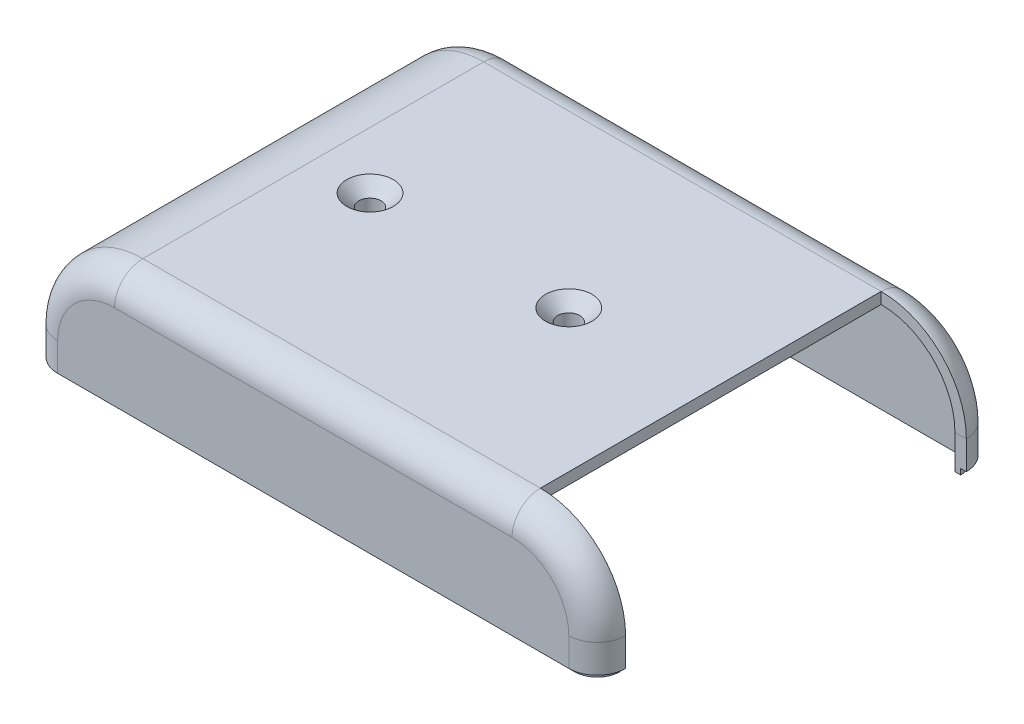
SolidWorks part; units mm, degrees
ref_plane "Front Plane" through (0, 0, 0) normal (0, 0, 1) x (1, 0, 0)
ref_plane "Top Plane" through (0, 0, 0) normal (0, 1, 0) x (1, 0, 0)
ref_plane "Right Plane" through (0, 0, 0) normal (1, 0, 0) x (0, 0, -1)
sketch "Sketch1" plane through (0, 0, 0) normal (0, 1, 0) x (1, 0, 0)
  line L1 (-50, 35) -> (50, 35)
  line L2 (-50, 35) -> (-50, -35)
  line L3 (-50, -35) -> (50, -35)
  line L4 (50, 35) -> (50, -35)
  line L5 (-50, 35) -> (50, -35) construction
  line L6 (-50, -35) -> (50, 35) construction
  point P0 (0, 0)
  dimension "D1" = 100
  dimension "D2" = 70
extrude "Boss-Extrude1" add sketch "Sketch1" along normal blind 20
fillet "Fillet1" radius 15 2 edges at (50, 20, 0) (-50, 20, 0)
fillet "Fillet2" radius 5 10 edges at (50, 2.5, -35) (45.6066, 15.6066, -35) (-50, 2.5, -35) (-45.6066, 15.6066, -35) (-50, 2.5, 35) (-45.6066, 15.6066, 35) (50, 2.5, 35) (45.6066, 15.6066, 35) (0, 20, -35) (0, 20, 35)
shell "Shell1" thickness 2
ref_plane "Plane1" through (0, 5, 0) normal (0, 1, 0) x (-1, 0, 0)
sketch "Sketch2" plane through (0, 5, 0) normal (0, 1, 0) x (-1, 0, 0)
  line L0 (50, 30) -> (50, -30) construction
  line L1 (35, -35) -> (-35, -35) construction
  circle A0 centre (-10, 0) radius 3
  circle A1 centre (25, 0) radius 3
  dimension "D1" = 6
  dimension "D2" = 25
  dimension "D3" = 35
  dimension "D4" = 35
extrude "Boss-Extrude2" add sketch "Sketch2" along normal up to next draft 5
hole_wizard "CSK for M3.5 Flat Head Machine Screw1" positions "Sketch4" profile "Sketch3" countersink size "M3.5" standard "Ansi Metric"
sketch "Sketch4" plane through (0, 20, 0) normal (0, 1, 0) x (-1, 0, 0)
  circle A0 centre (-10, 0) radius 3 construction
  circle A1 centre (25, 0) radius 3 construction
  point P0 (25, 0)
  point P1 (-10, 0)
sketch "Sketch3" plane through (-25, 20, 0) normal (1, 0, 0) x (0, 0, 1)
  line L0 (0, 0) -> (0, 20)
  line L1 (0, 20) -> (1.95, 20)
  line L2 (1.95, 20) -> (1.95, 2.15)
  line L3 (1.95, 2.15) -> (4.1, 0)
  line L5 (4.1, 0) -> (0, 0)
  line L6 (-1.95, 2.15) -> (-4.1, 0) construction
  line L11 (0, -6.35) -> (0, 107.95) construction
  dimension "Thru Hole Dia." = 3.9
  dimension "Thru Hole Depth" = 20
  dimension "Near C'Sink Dia." = 8.2
  dimension "Near C'Sink Angle" = 90
fillet "Fillet3" radius 1 2 edges at (-25, 18, 4.1374) (10, 18, 4.1374)
sketch "Sketch5" plane through (0, 0, 0) normal (0, -1, 0) x (1, 0, 0)
  line L0 (45, -33) -> (-45, -33) construction
  line L1 (-48, -30) -> (-48, 30) construction
  line L2 (-45, 33) -> (45, 33) construction
  line L3 (45, -33) -> (-45, -33)
  line L4 (-48, -30) -> (-48, 30)
  line L5 (-45, 33) -> (45, 33)
  arc A0 (45, -33) -> (48, -30) centre (45, -30) ccw construction
  arc A1 (-48, -30) -> (-45, -33) centre (-45, -30) ccw construction
  arc A2 (-45, 33) -> (-48, 30) centre (-45, 30) ccw construction
  arc A3 (48, 30) -> (45, 33) centre (45, 30) ccw construction
  arc A4 (45, -33) -> (48, -30) centre (45, -30) ccw
  arc A5 (-48, -30) -> (-45, -33) centre (-45, -30) ccw
  arc A6 (-45, 33) -> (-48, 30) centre (-45, 30) ccw
  arc A7 (48, 30) -> (45, 33) centre (45, 30) ccw
extrude "Extrude-Thin1" add sketch "Sketch5" along normal blind 1 thin
